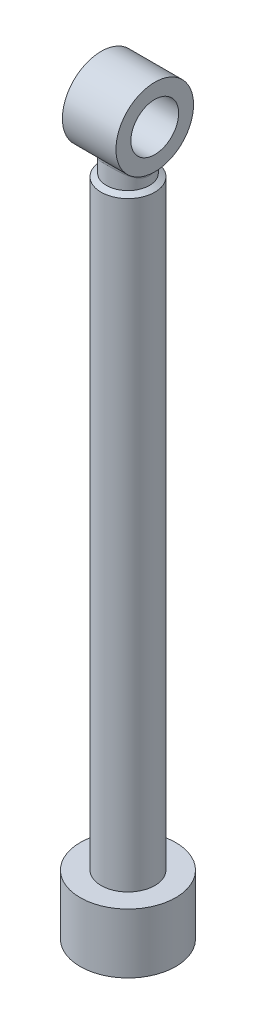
SolidWorks part; units mm, degrees
ref_plane "Plan de face" through (0, 0, 0) normal (0, 0, 1) x (1, 0, 0)
ref_plane "Plan de dessus" through (0, 0, 0) normal (0, 1, 0) x (1, 0, 0)
ref_plane "Plan de droite" through (0, 0, 0) normal (1, 0, 0) x (0, 0, -1)
sketch "Esquisse7" plane through (0, 0, 0) normal (1, 0, 0) x (0, 0, -1)
  circle A0 centre (-1624.1866, 499.5287) radius 20 construction
  circle A1 centre (-1624.1866, 499.5287) radius 32.5
  point P3 (-1624.1866, 479.5287)
  point P4 (-1624.1866, 467.0287)
  dimension "D1" = 65
  dimension "D2" = 12.5
extrude "Boss.-Extru.2" add sketch "Esquisse7" along normal mid plane 44.86 separate body
sketch "Esquisse8" plane through (0, 0, 0) normal (1, 0, 0) x (0, 0, -1)
  line L0 (-1624.1866, 499.5287) -> (-1624.1866, 429.16) construction
  line L1 (-1624.1866, 469.0287) -> (-1642.1866, 474.9066)
  line L2 (-1624.1866, 469.0287) -> (-1624.1866, -100.4713)
  line L3 (-1624.1866, -100.4713) -> (-1664.1866, -100.4713)
  line L4 (-1646.6866, 452.3085) -> (-1646.6866, -50.4713)
  line L5 (-1646.6866, -50.4713) -> (-1664.1866, -50.4713)
  line L6 (-1664.1866, -50.4713) -> (-1664.1866, -100.4713)
  line L7 (-1642.1866, 474.9066) -> (-1642.1866, 454.9066)
  line L8 (-1642.1866, 454.9066) -> (-1646.6866, 452.3085)
  circle A0 centre (-1624.1866, 499.5287) radius 30.5 construction
  circle A1 centre (-1624.1866, 499.5287) radius 32.5 construction
  point P7 (-1624.1866, 469.0287)
  point P9 (-1624.1866, 467.0287)
  dimension "D1" = 45
  dimension "D2" = 600
  dimension "D3" = 40
  dimension "D4" = 2
  dimension "D5" = 50
  dimension "D6" = 18
  dimension "D7" = 20
  dimension "D8" = 60
revolve "Révolution1" add sketch "Esquisse8" angle 360 about L0
sketch "Esquisse9" plane through (0, 0, 0) normal (1, 0, 0) x (0, 0, -1)
  circle A0 centre (-1624.1866, 499.5287) radius 20
  circle A1 centre (-1624.1866, 499.5287) radius 20 construction
extrude "Enlèv. mat.-Extru.1" cut sketch "Esquisse9" against normal mid plane 100
fillet "Congé2" radius 5 1 edges at (-1.5012, 472.427, 1606.2493)
sketch "Esquisse10" plane through (0, 0, 0) normal (1, 0, 0) x (0, 0, -1)
  line L0 (-1624.1866, -19.4745) -> (-1624.1866, 432.0471)
  line L1 (-1624.1866, -100.4713) -> (-1624.1866, -50.4713) construction
  point P2 (-1624.1866, 95.6919)
